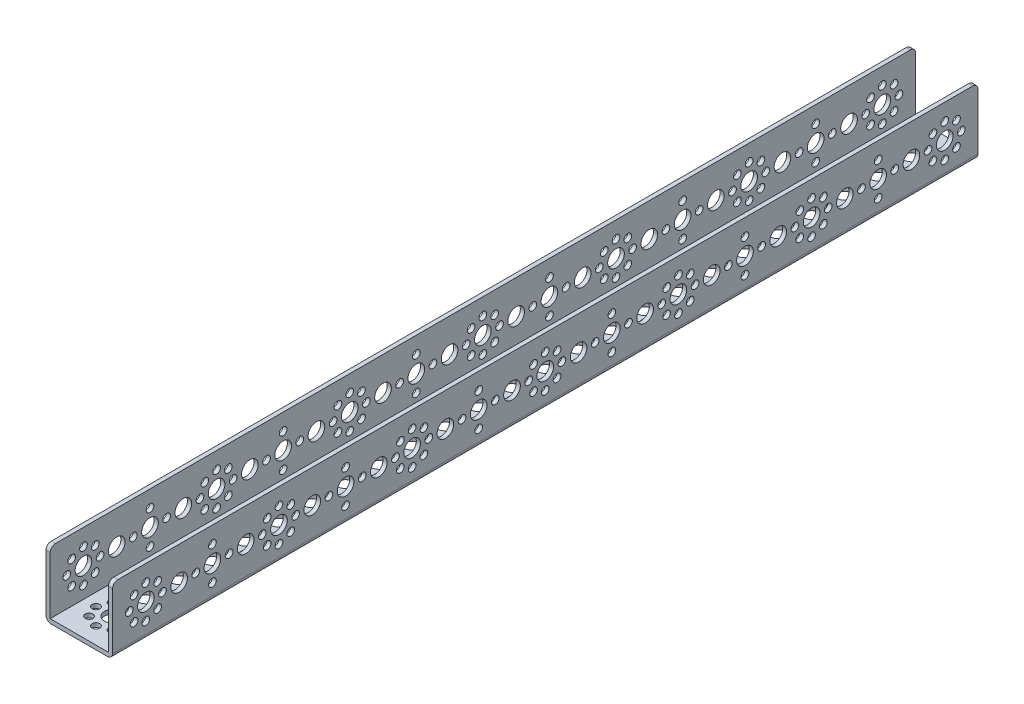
SolidWorks part; units mm, degrees
ref_plane "Front Plane" through (0, 0, 0) normal (0, 0, 1) x (1, 0, 0)
ref_plane "Top Plane" through (0, 0, 0) normal (0, 1, 0) x (1, 0, 0)
ref_plane "Right Plane" through (0, 0, 0) normal (1, 0, 0) x (0, 0, -1)
sketch "Sketch1" plane through (0, 0, 0) normal (0, 0, 1) x (1, 0, 0)
  line L0 (2.5, 0) -> (29.5, 0)
  line L1 (32, 2.5) -> (32, 32)
  line L2 (32, 32) -> (30, 32)
  line L3 (30, 32) -> (30, 2)
  line L4 (30, 2) -> (2, 2)
  line L5 (2, 2) -> (2, 32)
  line L6 (2, 32) -> (0, 32)
  line L7 (0, 32) -> (0, 2.5)
  arc A0 (0, 2.5) -> (2.5, 0) centre (2.5, 2.5) ccw
  arc A1 (32, 2.5) -> (29.5, 0) centre (29.5, 2.5) cw
  point P11 (0, 0)
  point P14 (32, 0)
  dimension "D6" = 2.5
  dimension "D1" = 32
  dimension "D2" = 2
  dimension "D3" = 2
  dimension "D4" = 32
  dimension "D5" = 2
extrude "Extrude1" add sketch "Sketch1" against normal blind 416
sketch "Sketch2"
sketch_block_instance "Block6-1"
sketch_block "Block6" parameters "D1"=16, "D2"=16, "D3"=16, "D4"=16, "D5"=16, "D6"=16, "D7"=16, "D8"=16
sketch_block_instance "Block5-1"
sketch_block "Block5"
sketch_block_instance "Block2-4"
sketch_block "Block2"
sketch_block_instance "Block5-2"
sketch_block_instance "Block2-5"
extrude "Cut-Extrude1" cut sketch "Sketch2" against normal through all
sketch "Sketch5" plane through (0, 0, 0) normal (0, -1, 0) x (1, 0, 0)
  line L0 (2.5, 0) -> (29.5, 0) construction
  line L1 (32, -416) -> (32, 0) construction
  line L2 (0, -416) -> (0, 0) construction
  dimension "D1" = 16
  dimension "D2" = 16
  dimension "D3" = 16
  dimension "D4" = 16
  dimension "D5" = 16
  dimension "D6" = 16
sketch_block_instance "Block6-3"
sketch_block_instance "Block6-11"
sketch_block_instance "Block2-10"
extrude "Cut-Extrude2" cut sketch "Sketch5" against normal up to surface (2 mm away)
fillet "Fillet1" radius 2.5 1 edges at (31, 32, 0)
fillet "Fillet2" radius 2.5 1 edges at (1, 32, 0)
fillet "Fillet3" radius 2.5 1 edges at (1, 32, -416)
fillet "Fillet4" radius 2.5 1 edges at (31, 32, -416)
sketch "Sketch7" plane through (0, 0, 0) normal (-1, 0, 0) x (0, 0, 1)
  line L0 (-413.5, 32) -> (-2.5, 32) construction
  line L1 (-416, 29.5) -> (-416, 2.5) construction
  dimension "D1" = 16
  dimension "D2" = 16
sketch_block_instance "Block6-6"
extrude "Cut-Extrude3" cut sketch "Sketch7" against normal through all
sketch "Sketch8" plane through (0, 0, 0) normal (-1, 0, 0) x (0, 0, 1)
  line L1 (-413.5, 32) -> (-2.5, 32) construction
  circle A0 centre (-288, 16) radius 4 construction
  dimension "D1" = 16
  dimension "D2" = 16
sketch_block_instance "Block2-7"
extrude "Cut-Extrude4" cut sketch "Sketch8" against normal through all
sketch "Sketch11" plane through (0, 0, 0) normal (-1, 0, 0) x (0, 0, 1)
  line L0 (-413.5, 32) -> (-2.5, 32) construction
  circle A0 centre (-272, 16) radius 4 construction
  dimension "D1" = 16
  dimension "D2" = 16
sketch_block_instance "Block6-14"
extrude "Cut-Extrude5" cut sketch "Sketch11" against normal through all
sketch "Sketch12" plane through (0, 0, 0) normal (0, -1, 0) x (1, 0, 0)
  circle A0 centre (16, -272) radius 4 construction
  dimension "D1" = 16
sketch_block_instance "Block6-16"
extrude "Cut-Extrude6" cut sketch "Sketch12" against normal up to surface (2 mm away)
